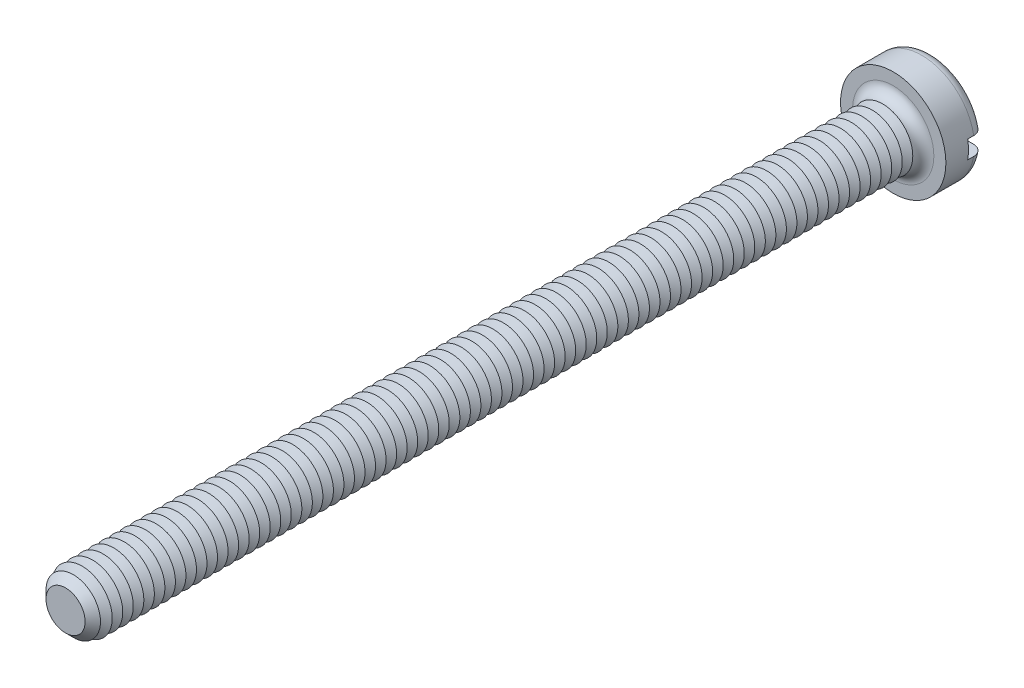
SolidWorks part; units mm, degrees
ref_plane "Front Plane" through (0, 0, 0) normal (0, 0, 1) x (1, 0, 0)
ref_plane "Top Plane" through (0, 0, 0) normal (0, 1, 0) x (1, 0, 0)
ref_plane "Right Plane" through (0, 0, 0) normal (1, 0, 0) x (0, 0, -1)
sketch "Sketch3" plane through (0, 0, 0) normal (0, 0, 1) x (1, 0, 0)
  circle A0 centre (0, 0) radius 3.5
  dimension "D1" = 7
extrude "Boss-Extrude2" add sketch "Sketch3" against normal blind 2.6
sketch "Sketch4" plane through (0, 0, 0) normal (0, 0, 1) x (1, 0, 0)
  circle A0 centre (0, 0) radius 2
  dimension "D1" = 4
extrude "Boss-Extrude3" add sketch "Sketch4" along normal blind 55
fillet "Fillet1" radius 0.7 2 edges at (3.5, 0, -2.6) (2, 0, 0)
chamfer "Chamfer1" distance 0.7 angle 45 1 edges at (2, 0, 55)
sketch "Sketch5" plane through (0, 0, 0) normal (1, 0, 0) x (0, 0, -1)
  line L0 (1.6944, 0) -> (-7.6738, 0) construction
sketch "Sketch6" plane through (0, 0, 0) normal (1, 0, 0) x (0, 0, -1)
  line L0 (-0.7, 2) -> (-1.05, 1.3938)
  line L1 (-1.05, 1.3938) -> (-1.4, 2)
  line L2 (-0.7, 2) -> (-54.3, 2) construction
  line L3 (-1.4, 2) -> (-0.7, 2)
  dimension "D1" = 0.7
revolve "Cut-Revolve1" cut sketch "Sketch6" angle 360 about L0
pattern_linear "LPattern1" count 77 spacing 0.7 along (0, 0, 1) of "Cut-Revolve1"
sketch "Sketch8" plane through (0, 0, -2.6) normal (0, 0, -1) x (-1, 0, 0)
  line L1 (3.5, -0.6) -> (-3.5, -0.6)
  line L2 (3.5, -0.6) -> (3.5, 0.6)
  line L3 (3.5, 0.6) -> (-3.5, 0.6)
  line L4 (-3.5, -0.6) -> (-3.5, 0.6)
  line L5 (3.5, -0.6) -> (-3.5, 0.6) construction
  line L6 (3.5, 0.6) -> (-3.5, -0.6) construction
  point P0 (0, 0)
  dimension "D1" = 7
  dimension "D2" = 1.2
extrude "Cut-Extrude1" cut sketch "Sketch8" against normal blind 1.1
